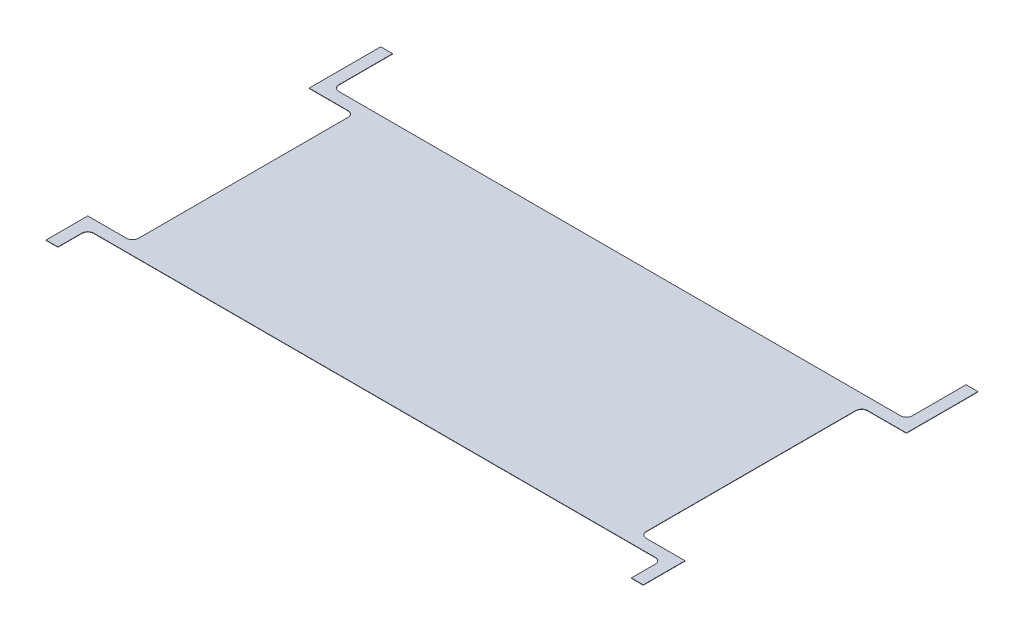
SolidWorks part; units mm, degrees
ref_plane "Front Plane" through (0, 0, 0) normal (0, 0, 1) x (1, 0, 0)
ref_plane "Top Plane" through (0, 0, 0) normal (0, 1, 0) x (1, 0, 0)
ref_plane "Right Plane" through (0, 0, 0) normal (1, 0, 0) x (0, 0, -1)
sketch "Sketch1" plane through (0, 0, 0) normal (0, 1, 0) x (1, 0, 0)
  line L0 (0, 0) -> (2, 0)
  line L1 (2, 0) -> (2, 4)
  line L2 (3, 5) -> (97.1, 5)
  line L3 (98.1, 4) -> (98.1, 0)
  line L4 (98.1, 0) -> (100.1, 0)
  line L5 (100.1, 0) -> (100.1, 7)
  line L6 (100.1, 7) -> (93.6, 7)
  line L7 (92.6, 8) -> (92.6, 43.1)
  line L8 (93.6, 44.1) -> (100.1, 44.1)
  line L9 (0, 0) -> (0, 7)
  line L10 (0, 7) -> (6.5, 7)
  line L11 (100.1, 44.1) -> (100.1, 56.1)
  line L12 (100.1, 56.1) -> (98.1, 56.1)
  line L13 (98.1, 56.1) -> (98.1, 47.1)
  line L14 (97.1, 46.1) -> (3, 46.1)
  line L15 (2, 47.1) -> (2, 56.1)
  line L16 (2, 56.1) -> (0, 56.1)
  line L17 (0, 56.1) -> (0, 44.1)
  line L18 (0, 44.1) -> (6.5, 44.1)
  line L19 (7.5, 43.1) -> (7.5, 8)
  arc A0 (98.1, 47.1) -> (97.1, 46.1) centre (97.1, 47.1) cw
  arc A1 (3, 46.1) -> (2, 47.1) centre (3, 47.1) cw
  arc A2 (7.5, 43.1) -> (6.5, 44.1) centre (6.5, 43.1) ccw
  arc A3 (7.5, 8) -> (6.5, 7) centre (6.5, 8) cw
  arc A4 (3, 5) -> (2, 4) centre (3, 4) ccw
  arc A5 (98.1, 4) -> (97.1, 5) centre (97.1, 4) ccw
  arc A6 (92.6, 8) -> (93.6, 7) centre (93.6, 8) ccw
  arc A7 (92.6, 43.1) -> (93.6, 44.1) centre (93.6, 43.1) cw
  point P23 (98.1, 46.1)
  point P30 (7.5, 7)
  point P33 (2, 5)
  point P36 (98.1, 5)
  point P39 (92.6, 7)
  point P42 (92.6, 44.1)
  dimension "D14" = 1
  dimension "D15" = 1
  dimension "D16" = 1
  dimension "D17" = 1
  dimension "D18" = 1
  dimension "D19" = 1
  dimension "D20" = 1
  dimension "D21" = 1
  dimension "D1" = 2
  dimension "D2" = 5
  dimension "D3" = 96.1
  dimension "D4" = 2
  dimension "D5" = 7
  dimension "D6" = 7.5
  dimension "D7" = 7.5
  dimension "D8" = 37.1
  dimension "D9" = 12
  dimension "D10" = 2
  dimension "D11" = 10
  dimension "D12" = 7
  dimension "D13" = 2
extrude "Boss-Extrude1" add sketch "Sketch1" along normal blind 0.05
